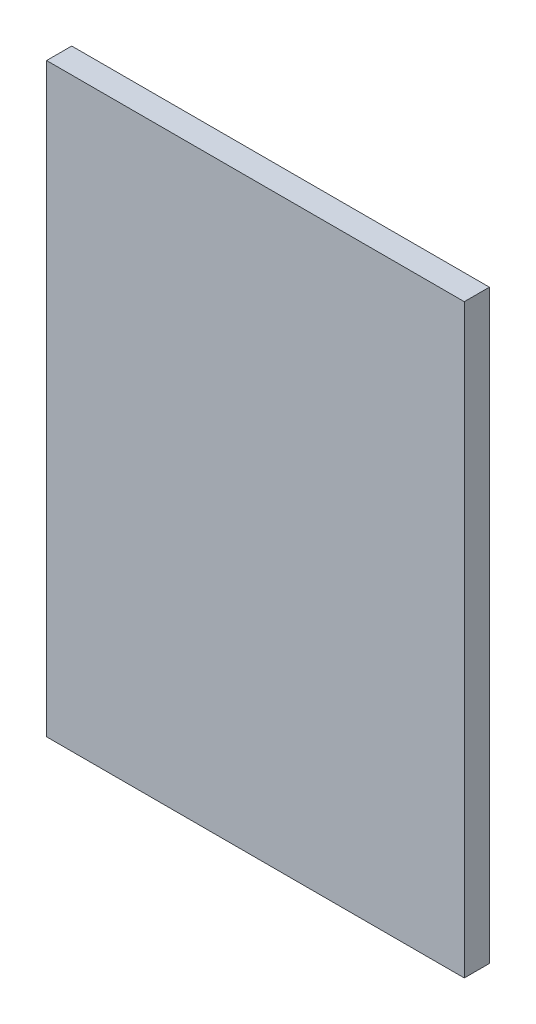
SolidWorks part; units mm, degrees
ref_plane "Спереди" through (0, 0, 0) normal (0, 0, 1) x (1, 0, 0)
ref_plane "Сверху" through (0, 0, 0) normal (0, 1, 0) x (1, 0, 0)
ref_plane "Справа" through (0, 0, 0) normal (1, 0, 0) x (0, 0, -1)
sketch "Эскиз1" plane through (0, 0, 0) normal (0, 0, 1) x (1, 0, 0)
  line L1 (-133, 186.5) -> (133, 186.5)
  line L2 (-133, 186.5) -> (-133, -186.5)
  line L3 (-133, -186.5) -> (133, -186.5)
  line L4 (133, 186.5) -> (133, -186.5)
  line L5 (-133, 186.5) -> (133, -186.5) construction
  line L6 (-133, -186.5) -> (133, 186.5) construction
  point P0 (0, 0)
extrude "Бобышка-Вытянуть1" add sketch "Эскиз1" along normal blind 16
